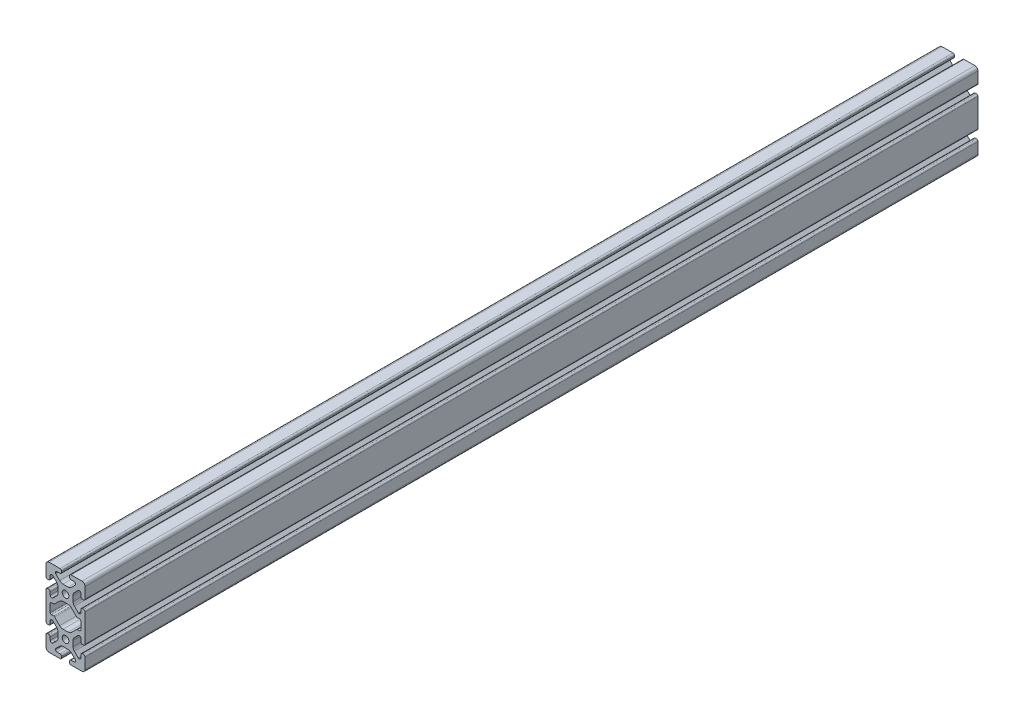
SolidWorks part; units mm, degrees
ref_plane "Front Plane" through (0, 0, 0) normal (0, 0, 1) x (1, 0, 0)
ref_plane "Top Plane" through (0, 0, 0) normal (0, 1, 0) x (1, 0, 0)
ref_plane "Right Plane" through (0, 0, 0) normal (1, 0, 0) x (0, 0, -1)
ref_plane "Plane1" through (0, 0, -3048) normal (0, 0, -1) x (-1, 0, 0)
sketch "Sketch1" plane through (0, 0, -3048) normal (0, 0, -1) x (-1, 0, 0)
  line L0 (14.41, 14.6586) -> (12.13, 14.6586)
  line L1 (11.1794, 14.2308) -> (6.0551, 9.1098)
  line L2 (2.6153, 7.685) -> (-2.6153, 7.685)
  line L3 (-6.0551, 9.1098) -> (-11.232, 14.2867)
  line L4 (-12.13, 14.6586) -> (-14.41, 14.6586)
  line L5 (-15.68, 15.9286) -> (-15.68, 24.0714)
  line L6 (-14.41, 25.3414) -> (-12.13, 25.3414)
  line L7 (-11.232, 25.7133) -> (-6.0551, 30.8902)
  line L8 (-2.6153, 32.315) -> (2.6176, 32.315)
  line L9 (6.0573, 30.8902) -> (11.1842, 25.7634)
  line L10 (12.13, 25.3414) -> (14.41, 25.3414)
  line L11 (15.68, 24.0714) -> (15.68, 15.9286)
  line L12 (16.83, 60) -> (5.6904, 60)
  line L13 (4.1204, 58.43) -> (4.1204, 57.25)
  line L14 (5.6904, 55.68) -> (8.7154, 55.68)
  line L15 (10.2854, 54.11) -> (10.2854, 53.6549)
  line L16 (10.0628, 53.1175) -> (6.0551, 49.1098)
  line L17 (2.6153, 47.685) -> (-2.6153, 47.685)
  line L18 (-6.0551, 49.1098) -> (-10.0628, 53.1175)
  line L19 (-10.2854, 53.6549) -> (-10.2854, 54.11)
  line L20 (-8.7154, 55.68) -> (-5.6904, 55.68)
  line L21 (-4.1204, 57.25) -> (-4.1204, 58.43)
  line L22 (-5.6904, 60) -> (-16.83, 60)
  line L23 (-20, 56.83) -> (-20, 45.6904)
  line L24 (-18.43, 44.1204) -> (-17.25, 44.1204)
  line L25 (-15.68, 45.6904) -> (-15.68, 48.7154)
  line L26 (-14.11, 50.2854) -> (-13.6527, 50.2854)
  line L27 (-13.1153, 50.0628) -> (-9.1098, 46.0573)
  line L28 (-7.685, 42.6176) -> (-7.685, 37.3847)
  line L29 (-9.1098, 33.9449) -> (-13.1175, 29.9372)
  line L30 (-13.6549, 29.7146) -> (-14.11, 29.7146)
  line L31 (-15.68, 31.2846) -> (-15.68, 34.3096)
  line L32 (-17.25, 35.8796) -> (-18.43, 35.8796)
  line L33 (-20, 34.3096) -> (-20, 5.6904)
  line L34 (-18.43, 4.1204) -> (-17.25, 4.1204)
  line L35 (-15.68, 5.6904) -> (-15.68, 8.7154)
  line L36 (-14.11, 10.2854) -> (-13.6549, 10.2854)
  line L37 (-13.1175, 10.0628) -> (-9.1098, 6.0551)
  line L38 (-7.685, 2.6153) -> (-7.685, -2.6153)
  line L39 (-9.1098, -6.0551) -> (-13.1175, -10.0628)
  line L40 (-13.6549, -10.2854) -> (-14.11, -10.2854)
  line L41 (-15.68, -8.7154) -> (-15.68, -5.6904)
  line L42 (-17.25, -4.1204) -> (-18.43, -4.1204)
  line L43 (-20, -5.6904) -> (-20, -16.83)
  line L44 (-16.83, -20) -> (-5.6904, -20)
  line L45 (-4.1204, -18.43) -> (-4.1204, -17.25)
  line L46 (-5.6904, -15.68) -> (-8.7154, -15.68)
  line L47 (-10.2854, -14.11) -> (-10.2854, -13.6549)
  line L48 (-10.0628, -13.1175) -> (-6.0551, -9.1098)
  line L49 (-2.6153, -7.685) -> (2.6153, -7.685)
  line L50 (6.0551, -9.1098) -> (10.0628, -13.1175)
  line L51 (10.2854, -13.6549) -> (10.2854, -14.11)
  line L52 (8.7154, -15.68) -> (5.6904, -15.68)
  line L53 (4.1204, -17.25) -> (4.1204, -18.43)
  line L54 (5.6904, -20) -> (16.83, -20)
  line L55 (20, -16.83) -> (20, -5.6904)
  line L56 (18.43, -4.1204) -> (17.25, -4.1204)
  line L57 (15.68, -5.6904) -> (15.68, -8.7154)
  line L58 (14.11, -10.2854) -> (13.6549, -10.2854)
  line L59 (13.1175, -10.0628) -> (9.1098, -6.0551)
  line L60 (7.685, -2.6153) -> (7.685, 2.6153)
  line L61 (9.1098, 6.0551) -> (13.1175, 10.0628)
  line L62 (13.6549, 10.2854) -> (14.11, 10.2854)
  line L63 (15.68, 8.7154) -> (15.68, 5.6904)
  line L64 (17.25, 4.1204) -> (18.43, 4.1204)
  line L65 (20, 5.6904) -> (20, 34.3096)
  line L66 (18.43, 35.8796) -> (17.25, 35.8796)
  line L67 (15.68, 34.3096) -> (15.68, 31.2846)
  line L68 (14.11, 29.7146) -> (13.6549, 29.7146)
  line L69 (13.1175, 29.9372) -> (9.1098, 33.9449)
  line L70 (7.685, 37.3847) -> (7.685, 42.6153)
  line L71 (9.1098, 46.0551) -> (13.1175, 50.0628)
  line L72 (13.6549, 50.2854) -> (14.11, 50.2854)
  line L73 (15.68, 48.7154) -> (15.68, 45.6904)
  line L74 (17.25, 44.1204) -> (18.43, 44.1204)
  line L75 (20, 45.6904) -> (20, 56.83)
  arc A0 (15.68, 15.9286) -> (14.41, 14.6586) centre (14.41, 15.9286) cw
  arc A1 (12.13, 14.6586) -> (11.1794, 14.2308) centre (12.13, 13.3886) ccw
  arc A2 (6.0551, 9.1098) -> (2.6153, 7.685) centre (2.6153, 12.5496) cw
  arc A3 (-2.6153, 7.685) -> (-6.0551, 9.1098) centre (-2.6153, 12.5496) cw
  arc A4 (-11.232, 14.2867) -> (-12.13, 14.6586) centre (-12.13, 13.3886) ccw
  arc A5 (-14.41, 14.6586) -> (-15.68, 15.9286) centre (-14.41, 15.9286) cw
  arc A6 (-15.68, 24.0714) -> (-14.41, 25.3414) centre (-14.41, 24.0714) cw
  arc A7 (-12.13, 25.3414) -> (-11.232, 25.7133) centre (-12.13, 26.6114) ccw
  arc A8 (-6.0551, 30.8902) -> (-2.6153, 32.315) centre (-2.6153, 27.4504) cw
  arc A9 (2.6176, 32.315) -> (6.0573, 30.8902) centre (2.6176, 27.4504) cw
  arc A10 (11.1842, 25.7634) -> (12.13, 25.3414) centre (12.13, 26.6123) ccw
  arc A11 (14.41, 25.3414) -> (15.68, 24.0714) centre (14.41, 24.0714) cw
  circle A12 centre (0, 0) radius 3.405
  circle A13 centre (0, 40) radius 3.405
  arc A14 (5.6904, 60) -> (4.1204, 58.43) centre (5.6904, 58.43) ccw
  arc A15 (4.1204, 57.25) -> (5.6904, 55.68) centre (5.6904, 57.25) ccw
  arc A16 (8.7154, 55.68) -> (10.2854, 54.11) centre (8.7154, 54.11) cw
  arc A17 (10.2854, 53.6549) -> (10.0628, 53.1175) centre (9.5254, 53.6549) cw
  arc A18 (6.0551, 49.1098) -> (2.6153, 47.685) centre (2.6153, 52.5496) cw
  arc A19 (-2.6153, 47.685) -> (-6.0551, 49.1098) centre (-2.6153, 52.5496) cw
  arc A20 (-10.0628, 53.1175) -> (-10.2854, 53.6549) centre (-9.5254, 53.6549) cw
  arc A21 (-10.2854, 54.11) -> (-8.7154, 55.68) centre (-8.7154, 54.11) cw
  arc A22 (-5.6904, 55.68) -> (-4.1204, 57.25) centre (-5.6904, 57.25) ccw
  arc A23 (-4.1204, 58.43) -> (-5.6904, 60) centre (-5.6904, 58.43) ccw
  arc A24 (-16.83, 60) -> (-20, 56.83) centre (-16.83, 56.83) ccw
  arc A25 (-20, 45.6904) -> (-18.43, 44.1204) centre (-18.43, 45.6904) ccw
  arc A26 (-17.25, 44.1204) -> (-15.68, 45.6904) centre (-17.25, 45.6904) ccw
  arc A27 (-15.68, 48.7154) -> (-14.11, 50.2854) centre (-14.11, 48.7154) cw
  arc A28 (-13.6527, 50.2854) -> (-13.1153, 50.0628) centre (-13.6527, 49.5254) cw
  arc A29 (-9.1098, 46.0573) -> (-7.685, 42.6176) centre (-12.5496, 42.6176) cw
  arc A30 (-7.685, 37.3847) -> (-9.1098, 33.9449) centre (-12.5496, 37.3847) cw
  arc A31 (-13.1175, 29.9372) -> (-13.6549, 29.7146) centre (-13.6549, 30.4746) cw
  arc A32 (-14.11, 29.7146) -> (-15.68, 31.2846) centre (-14.11, 31.2846) cw
  arc A33 (-15.68, 34.3096) -> (-17.25, 35.8796) centre (-17.25, 34.3096) ccw
  arc A34 (-18.43, 35.8796) -> (-20, 34.3096) centre (-18.43, 34.3096) ccw
  arc A35 (-20, 5.6904) -> (-18.43, 4.1204) centre (-18.43, 5.6904) ccw
  arc A36 (-17.25, 4.1204) -> (-15.68, 5.6904) centre (-17.25, 5.6904) ccw
  arc A37 (-15.68, 8.7154) -> (-14.11, 10.2854) centre (-14.11, 8.7154) cw
  arc A38 (-13.6549, 10.2854) -> (-13.1175, 10.0628) centre (-13.6549, 9.5254) cw
  arc A39 (-9.1098, 6.0551) -> (-7.685, 2.6153) centre (-12.5496, 2.6153) cw
  arc A40 (-7.685, -2.6153) -> (-9.1098, -6.0551) centre (-12.5496, -2.6153) cw
  arc A41 (-13.1175, -10.0628) -> (-13.6549, -10.2854) centre (-13.6549, -9.5254) cw
  arc A42 (-14.11, -10.2854) -> (-15.68, -8.7154) centre (-14.11, -8.7154) cw
  arc A43 (-15.68, -5.6904) -> (-17.25, -4.1204) centre (-17.25, -5.6904) ccw
  arc A44 (-18.43, -4.1204) -> (-20, -5.6904) centre (-18.43, -5.6904) ccw
  arc A45 (-20, -16.83) -> (-16.83, -20) centre (-16.83, -16.83) ccw
  arc A46 (-5.6904, -20) -> (-4.1204, -18.43) centre (-5.6904, -18.43) ccw
  arc A47 (-4.1204, -17.25) -> (-5.6904, -15.68) centre (-5.6904, -17.25) ccw
  arc A48 (-8.7154, -15.68) -> (-10.2854, -14.11) centre (-8.7154, -14.11) cw
  arc A49 (-10.2854, -13.6549) -> (-10.0628, -13.1175) centre (-9.5254, -13.6549) cw
  arc A50 (-6.0551, -9.1098) -> (-2.6153, -7.685) centre (-2.6153, -12.5496) cw
  arc A51 (2.6153, -7.685) -> (6.0551, -9.1098) centre (2.6153, -12.5496) cw
  arc A52 (10.0628, -13.1175) -> (10.2854, -13.6549) centre (9.5254, -13.6549) cw
  arc A53 (10.2854, -14.11) -> (8.7154, -15.68) centre (8.7154, -14.11) cw
  arc A54 (5.6904, -15.68) -> (4.1204, -17.25) centre (5.6904, -17.25) ccw
  arc A55 (4.1204, -18.43) -> (5.6904, -20) centre (5.6904, -18.43) ccw
  arc A56 (16.83, -20) -> (20, -16.83) centre (16.83, -16.83) ccw
  arc A57 (20, -5.6904) -> (18.43, -4.1204) centre (18.43, -5.6904) ccw
  arc A58 (17.25, -4.1204) -> (15.68, -5.6904) centre (17.25, -5.6904) ccw
  arc A59 (15.68, -8.7154) -> (14.11, -10.2854) centre (14.11, -8.7154) cw
  arc A60 (13.6549, -10.2854) -> (13.1175, -10.0628) centre (13.6549, -9.5254) cw
  arc A61 (9.1098, -6.0551) -> (7.685, -2.6153) centre (12.5496, -2.6153) cw
  arc A62 (7.685, 2.6153) -> (9.1098, 6.0551) centre (12.5496, 2.6153) cw
  arc A63 (13.1175, 10.0628) -> (13.6549, 10.2854) centre (13.6549, 9.5254) cw
  arc A64 (14.11, 10.2854) -> (15.68, 8.7154) centre (14.11, 8.7154) cw
  arc A65 (15.68, 5.6904) -> (17.25, 4.1204) centre (17.25, 5.6904) ccw
  arc A66 (18.43, 4.1204) -> (20, 5.6904) centre (18.43, 5.6904) ccw
  arc A67 (20, 34.3096) -> (18.43, 35.8796) centre (18.43, 34.3096) ccw
  arc A68 (17.25, 35.8796) -> (15.68, 34.3096) centre (17.25, 34.3096) ccw
  arc A69 (15.68, 31.2846) -> (14.11, 29.7146) centre (14.11, 31.2846) cw
  arc A70 (13.6549, 29.7146) -> (13.1175, 29.9372) centre (13.6549, 30.4746) cw
  arc A71 (9.1098, 33.9449) -> (7.685, 37.3847) centre (12.5496, 37.3847) cw
  arc A72 (7.685, 42.6153) -> (9.1098, 46.0551) centre (12.5496, 42.6153) cw
  arc A73 (13.1175, 50.0628) -> (13.6549, 50.2854) centre (13.6549, 49.5254) cw
  arc A74 (14.11, 50.2854) -> (15.68, 48.7154) centre (14.11, 48.7154) cw
  arc A75 (15.68, 45.6904) -> (17.25, 44.1204) centre (17.25, 45.6904) ccw
  arc A76 (18.43, 44.1204) -> (20, 45.6904) centre (18.43, 45.6904) ccw
  arc A77 (20, 56.83) -> (16.83, 60) centre (16.83, 56.83) ccw
extrude "Boss-Extrude1" add sketch "Sketch1" against normal blind 3048
ref_plane "Plane2" through (0, 0, -914.4) normal (0, 0, 1) x (1, 0, 0)
ref_plane "Plane3" through (0, 0, -1828.8) normal (0, 0, 1) x (1, 0, 0)
ref_plane "Plane4" through (0, 0, -2133.6) normal (0, 0, 1) x (1, 0, 0)
ref_plane "Plane5" through (0, 0, -2438.4) normal (0, 0, 1) x (1, 0, 0)
sketch "Sketch26" plane through (0, 0, -914.4) normal (0, 0, 1) x (1, 0, 0)
  line L0 (-20, -20.8001) -> (20, -20.8001)
  line L1 (-20, -20.8001) -> (-20, 60)
  line L2 (-20, 60) -> (20, 60)
  line L3 (20, -20.8001) -> (20, 60)
sketch "Sketch33" plane through (0, 0, -1828.8) normal (0, 0, 1) x (1, 0, 0)
  line L0 (-20, -20.8001) -> (20, -20.8001)
  line L1 (-20, -20.8001) -> (-20, 60)
  line L2 (-20, 60) -> (20, 60)
  line L3 (20, -20.8001) -> (20, 60)
sketch "Sketch41" plane through (0, 0, -2133.6) normal (0, 0, 1) x (1, 0, 0)
  line L0 (-20, -20.8001) -> (20, -20.8001)
  line L1 (-20, -20.8001) -> (-20, 60)
  line L2 (-20, 60) -> (20, 60)
  line L3 (20, -20.8001) -> (20, 60)
sketch "Sketch50" plane through (0, 0, -2438.4) normal (0, 0, 1) x (1, 0, 0)
  line L0 (-20, -20.8001) -> (20, -20.8001)
  line L1 (-20, -20.8001) -> (-20, 60)
  line L2 (-20, 60) -> (20, 60)
  line L3 (20, -20.8001) -> (20, 60)
extrude "Cut 1 - 3ft" cut sketch "Sketch26" against normal through all
